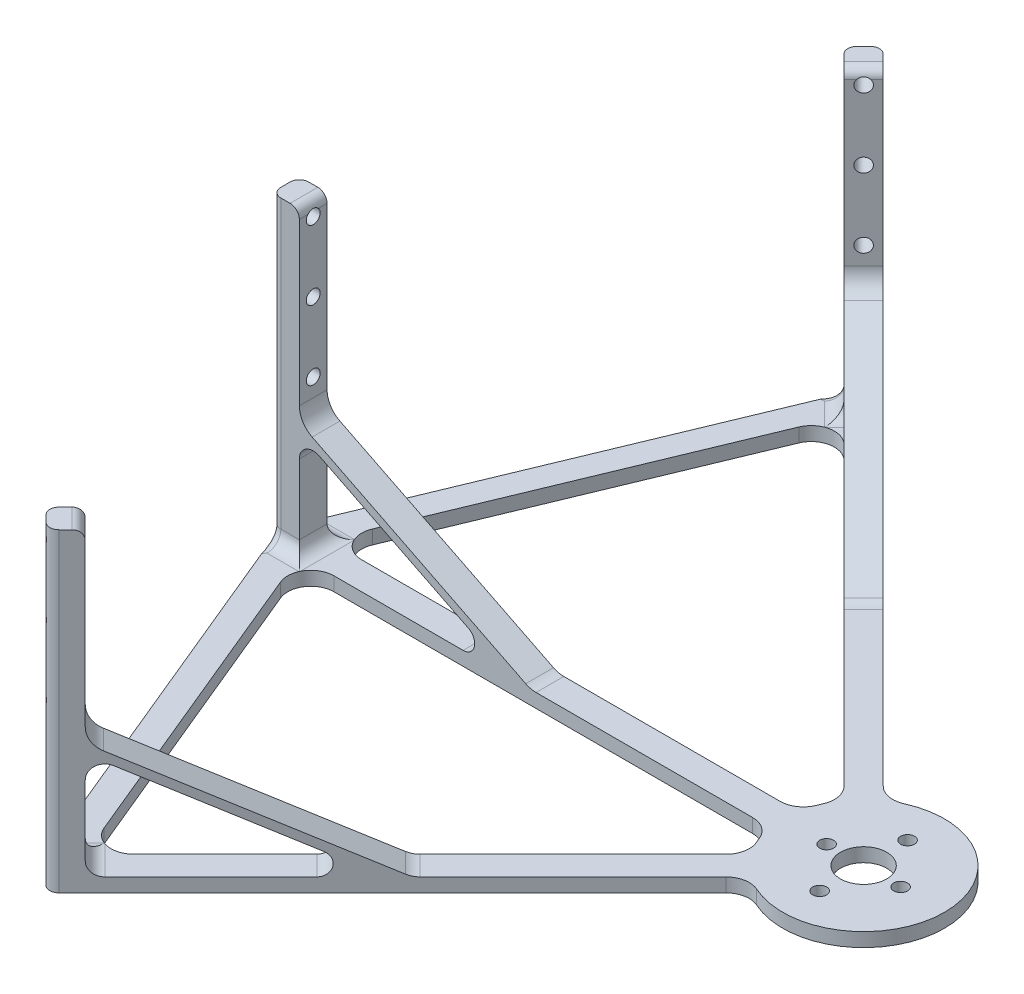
SolidWorks part; units mm, degrees
ref_plane "前视基准面" through (0, 0, 0) normal (0, 0, 1) x (1, 0, 0)
ref_plane "上视基准面" through (0, 0, 0) normal (0, 1, 0) x (1, 0, 0)
ref_plane "右视基准面" through (0, 0, 0) normal (1, 0, 0) x (0, 0, -1)
other "Configuration Table"
sketch "草图1" plane through (0, 0, 0) normal (0, 1, 0) x (1, 0, 0)
  line L0 (-17.2409, 3) -> (-17.2409, -3)
  line L1 (-17.2409, 3) -> (-125, 3)
  line L2 (-17.2409, -3) -> (-125, -3)
  line L3 (-125, 3) -> (-125, -3)
  line L4 (-10.0699, 14.3125) -> (-14.3125, 10.0699)
  line L5 (-10.0699, 14.3125) -> (-86.267, 90.5097)
  line L6 (-86.267, 90.5097) -> (-90.5097, 86.267)
  line L7 (-14.3125, 10.0699) -> (-90.5097, 86.267)
  line L12 (-14.3125, -10.0699) -> (-10.0699, -14.3125)
  line L13 (-14.3125, -10.0699) -> (-90.5097, -86.267)
  line L14 (-90.5097, -86.267) -> (-86.267, -90.5097)
  line L15 (-10.0699, -14.3125) -> (-86.267, -90.5097)
  line L22 (-125, -3) -> (-90.5097, -86.267)
  line L23 (-86.267, -82.0244) -> (-119, -3)
  line L24 (-125, 3) -> (-90.5097, 86.267)
  line L25 (-86.267, 82.0244) -> (-119, 3)
  line L29 (-3, -17.2409) -> (3, -17.2409)
  line L30 (3, -17.2409) -> (3, -125)
  line L31 (-3, -125) -> (3, -125)
  line L32 (-3, -17.2409) -> (-3, -125)
  line L33 (3, 17.2409) -> (-3, 17.2409)
  line L34 (-3, 17.2409) -> (-3, 125)
  line L35 (3, 125) -> (-3, 125)
  line L36 (3, 17.2409) -> (3, 125)
  circle A0 centre (0, 0) radius 17.5
  circle A1 centre (0, 0) radius 5
  circle A2 centre (-8, 0) radius 1.5
  circle A3 centre (8, 0) radius 1.5
  circle A4 centre (0, 9.5) radius 1.5
  circle A5 centre (0, -9.5) radius 1.5
  point P27 (0, 0)
  point P35 (0, 0)
  dimension "D1" = 125
  dimension "D2" = 6
  dimension "D3" = 3
  dimension "D4" = 3
sketch "草图6" plane through (0, 0, 0) normal (0, 0, 1) x (1, 0, 0)
  line L0 (0, 0) -> (0, 84.0677) construction
extrude "凸台-拉伸4" add sketch "草图1" along normal blind 3 contours A0 L5 L6 L7 | L25 L7 L24 L1 | A0 L1 L3 L2 | L13 L23 L2 L22 | A0 L13 L14 L15 | L4 A0 L0 L12 A5 A4 A3 A2 A1
sketch "草图9" plane through (0, 3, 0) normal (0, 1, 0) x (1, 0, 0)
  line L0 (-90.5097, -86.267) -> (-86.267, -90.5097)
  line L1 (-90.5097, -86.267) -> (-86.267, -82.0244)
  line L2 (-86.267, -90.5097) -> (-82.0244, -86.267)
  line L3 (-86.267, -82.0244) -> (-82.0244, -86.267)
  line L4 (-125, 3) -> (-125, -3)
  line L5 (-125, 3) -> (-119, 3)
  line L6 (-119, 3) -> (-119, -3)
  line L7 (-125, -3) -> (-119, -3)
  line L8 (-86.267, 90.5097) -> (-90.5097, 86.267)
  line L9 (-86.267, 90.5097) -> (-82.0244, 86.267)
  line L10 (-82.0244, 86.267) -> (-86.267, 82.0244)
  line L11 (-90.5097, 86.267) -> (-86.267, 82.0244)
  point P17 (0, 0)
  dimension "D1" = 6
  dimension "D2" = 3
extrude "凸台-拉伸5" add sketch "草图9" along normal blind 65
sketch "草图10" plane through (-88.3883, 0, 88.3883) normal (-0.7071, 0, 0.7071) x (0.7071, 0, 0.7071)
  line L0 (0, -200000) -> (0, 200084.0677) construction
  circle A0 centre (0, 65) radius 1.5
  circle A1 centre (0, 50) radius 1.5
  circle A2 centre (0, 35) radius 1.5
extrude "切除-拉伸2" cut sketch "草图10" against normal up to next
pattern_circular "阵列(圆周)3" count 3 every 45 about axis through (0, 0, 0) along (0, 1, 0) of "切除-拉伸2"
fillet "圆角6" radius 5 10 edges at (-10.0699, 1.5, 14.3125) (-10.0699, 1.5, -14.3125) (-14.3125, 1.5, -10.0699) (-17.2409, 1.5, -3) (-17.2409, 1.5, 3) (-14.3125, 1.5, 10.0699) (-86.267, 1.5, -82.0244) (-119, 1.5, 3) (-119, 1.5, -3) (-86.267, 1.5, 82.0244)
sketch "草图11" plane through (2.1213, 0, 2.1213) normal (0.7071, 0, 0.7071) x (0.7071, 0, -0.7071)
  line L0 (-119, 26) -> (-73, 3)
  line L3 (-119, 68) -> (-119, 3) construction
  line L4 (-21.0297, 3) -> (-119, 3) construction
  line L5 (-73, 3) -> (-69, 3)
  line L6 (-69, 3) -> (-119, 28)
  line L7 (-119, 28) -> (-119, 26)
  dimension "D1" = 23
  dimension "D2" = 25
  dimension "D3" = 46
extrude "凸台-拉伸7" add sketch "草图11" against normal blind 6
pattern_circular "阵列(圆周)6" count 3 every 45 about axis through (0, 0, 0) along (0, 1, 0) of "凸台-拉伸7"
fillet "圆角10" radius 5 6 edges at (-48.7904, 3, -48.7904) (-69, 3, 0) (-48.7904, 3, 48.7904) (-84.1457, 28, -84.1457) (-119, 28, 0) (-84.1457, 28, 84.1457)
fillet "圆角11" radius 2.5 3 edges at (-51.6188, 3, -51.6188) (-73, 3, 0) (-51.6188, 3, 51.6188)
fillet "圆角12" radius 3 3 edges at (-84.1457, 3, -84.1457) (-119, 3, 0) (-84.1457, 3, 84.1457)
fillet "圆角13" radius 3 3 edges at (-84.1457, 26, -84.1457) (-119, 26, 0) (-84.1457, 26, 84.1457)
fillet "圆角14" radius 3 4 edges at (-87.3277, 3, -83.085) (-120.5, 3, -3) (-120.5, 3, 3) (-87.3277, 3, 83.085)
fillet "圆角15" radius 2 13 edges at (-90.5097, 37, -86.267) (-125, 37, -3) (-125, 37, 3) (-90.5097, 37, 86.267) (-119, 68, 0) (-84.1457, 68, 84.1457) (-84.1457, 68, -84.1457) (-86.267, 34, -90.5097) (-90.5097, 3, -86.267) (-125, 3, -3) (-125, 3, 3) (-86.267, 34, 90.5097) (-90.5097, 3, 86.267)
